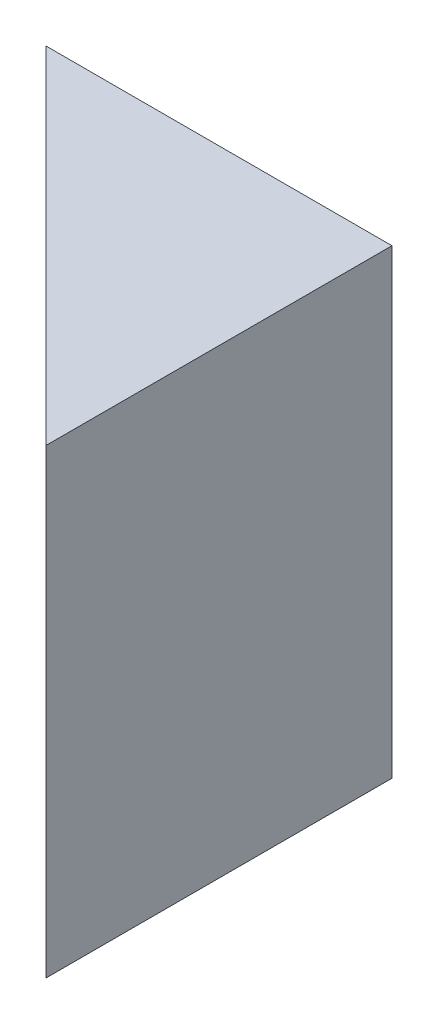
SolidWorks part; units mm, degrees
ref_plane "Front Plane" through (0, 0, 0) normal (0, 0, 1) x (1, 0, 0)
ref_plane "Top Plane" through (0, 0, 0) normal (0, 1, 0) x (1, 0, 0)
ref_plane "Right Plane" through (0, 0, 0) normal (1, 0, 0) x (0, 0, -1)
sketch "Sketch1" plane through (0, 0, 0) normal (0, 1, 0) x (1, 0, 0)
  line L0 (-38.1, 38.1) -> (38.1, -38.1)
  line L1 (-38.1, 38.1) -> (38.1, 38.1)
  line L4 (38.1, 38.1) -> (38.1, -38.1)
  line L5 (-38.1, 38.1) -> (38.1, -38.1) construction
  line L6 (0, 0) -> (38.1, 38.1) construction
  point P0 (0, 0)
  dimension "D1" = 76.2
  dimension "D2" = 76.2
extrude "Boss-Extrude1" add sketch "Sketch1" along normal blind 101.6
